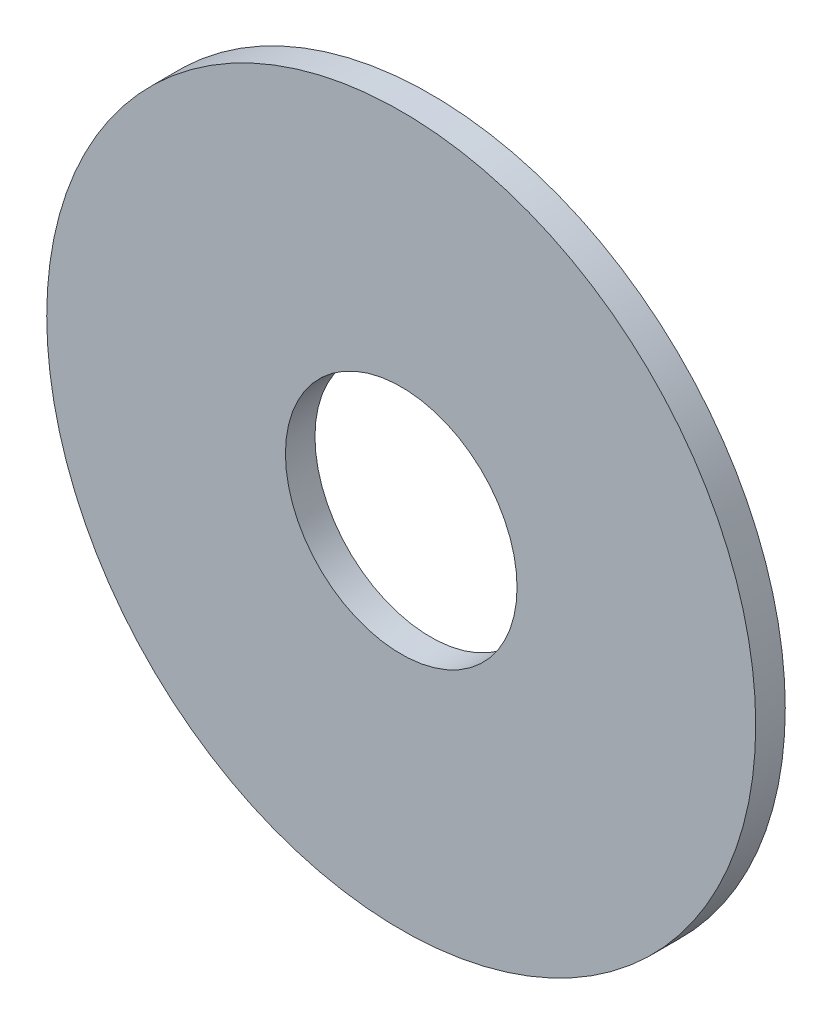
SolidWorks part; units mm, degrees
ref_plane "Plan de face" through (0, 0, 0) normal (0, 0, 1) x (1, 0, 0)
ref_plane "Plan de dessus" through (0, 0, 0) normal (0, 1, 0) x (1, 0, 0)
ref_plane "Plan de droite" through (0, 0, 0) normal (1, 0, 0) x (0, 0, -1)
sketch "Esquisse1" plane through (0, 0, 0) normal (0, 0, 1) x (1, 0, 0)
  circle A0 centre (0, 0) radius 6
  circle A1 centre (0, 0) radius 1.96
extrude "Extrusion1" add sketch "Esquisse1" along normal blind 0.5
